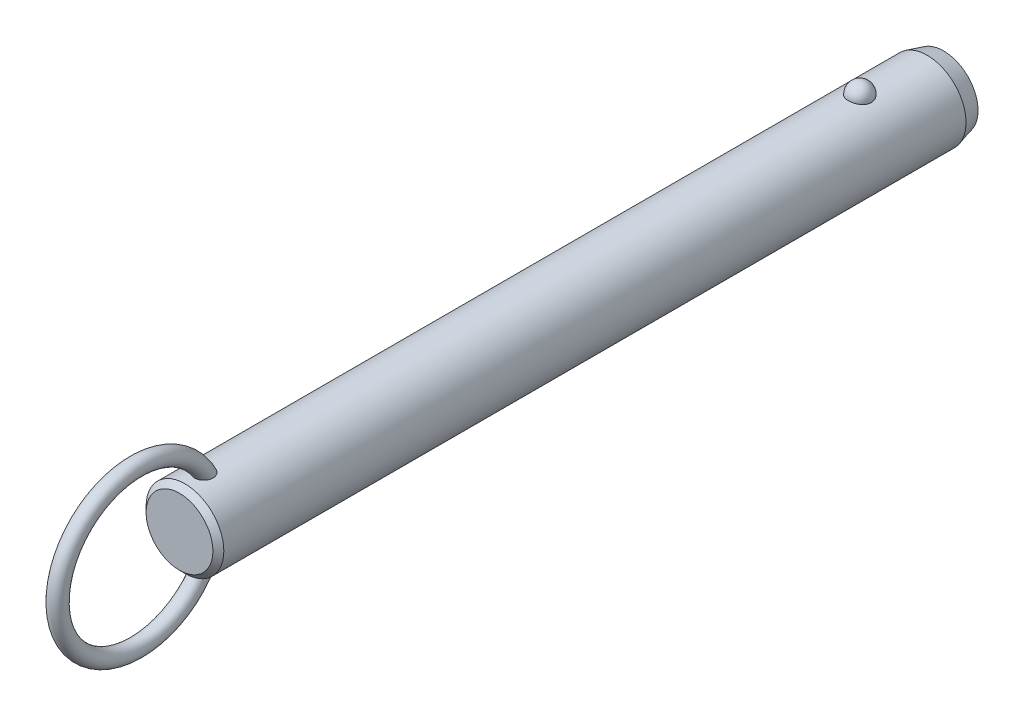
SolidWorks part; units mm, degrees
ref_plane "Front Plane" through (0, 0, 0) normal (0, 0, 1) x (1, 0, 0)
ref_plane "Top Plane" through (0, 0, 0) normal (0, 1, 0) x (1, 0, 0)
ref_plane "Right Plane" through (0, 0, 0) normal (1, 0, 0) x (0, 0, -1)
sketch "Sketch2" plane through (0, 0, 0) normal (0, 0, 1) x (1, 0, 0)
  circle A0 centre (0, 0) radius 7.1
  point P3 (0, 7.1)
  dimension "D1" = 14.2
extrude "Boss-Extrude1" add sketch "Sketch2" along normal blind 114.3
sketch "Sketch3" plane through (0, 0, 0) normal (0, 0, -1) x (-1, 0, 0)
  circle A0 centre (0, 0) radius 7.1
  dimension "D1" = 14.2
extrude "Boss-Extrude2" add sketch "Sketch3" along normal blind 17.4
chamfer "Chamfer1" distance 3 angle 15 1 edges at (-7.1, 0, -17.4)
sketch "Sketch12" plane through (0, 0, 0) normal (1, 0, 0) x (0, 0, -1)
  line L0 (-114.3, 7.1) -> (-114.3, -7.1) construction
  point P0 (-114.3, 0)
sketch "Sketch13" plane through (0, 0, 0) normal (1, 0, 0) x (0, 0, -1)
  circle A0 centre (-130.15, 0) radius 15.85
  point P2 (-114.3, 0)
  dimension "D1" = 31.7
sketch "Sketch14" plane through (0, 0, 0) normal (0, 1, 0) x (1, 0, 0)
  circle A0 centre (0, -115.8) radius 1.5
  point P2 (0, -114.3)
  dimension "D1" = 3
sweep "Sweep1" add profiles "Sketch14" path "Sketch13"
sketch "Sketch15" plane through (0, 0, 114.3) normal (0, 0, 1) x (1, 0, 0)
  circle A0 centre (0, 0) radius 7.1
  dimension "D1" = 14.2
extrude "Boss-Extrude3" add sketch "Sketch15" along normal blind 7.92
chamfer "Chamfer2" distance 1 angle 45 1 edges at (7.1, 0, 122.22)
sketch "Sketch18" plane through (0, 0, 0) normal (1, 0, 0) x (0, 0, -1)
  line L0 (14.4, 7.1) -> (-115.9792, 7.1) construction
  line L1 (2.1, 9.2) -> (2.1, 5)
  line L2 (-115.9792, -7.1) -> (14.4, -7.1) construction
  arc A0 (2.1, 9.2) -> (2.1, 5) centre (2.1, 7.1) ccw
  point P4 (0, 7.1)
  dimension "D1" = 16.3
revolve "Revolve1" add sketch "Sketch18" angle 360 about L1
